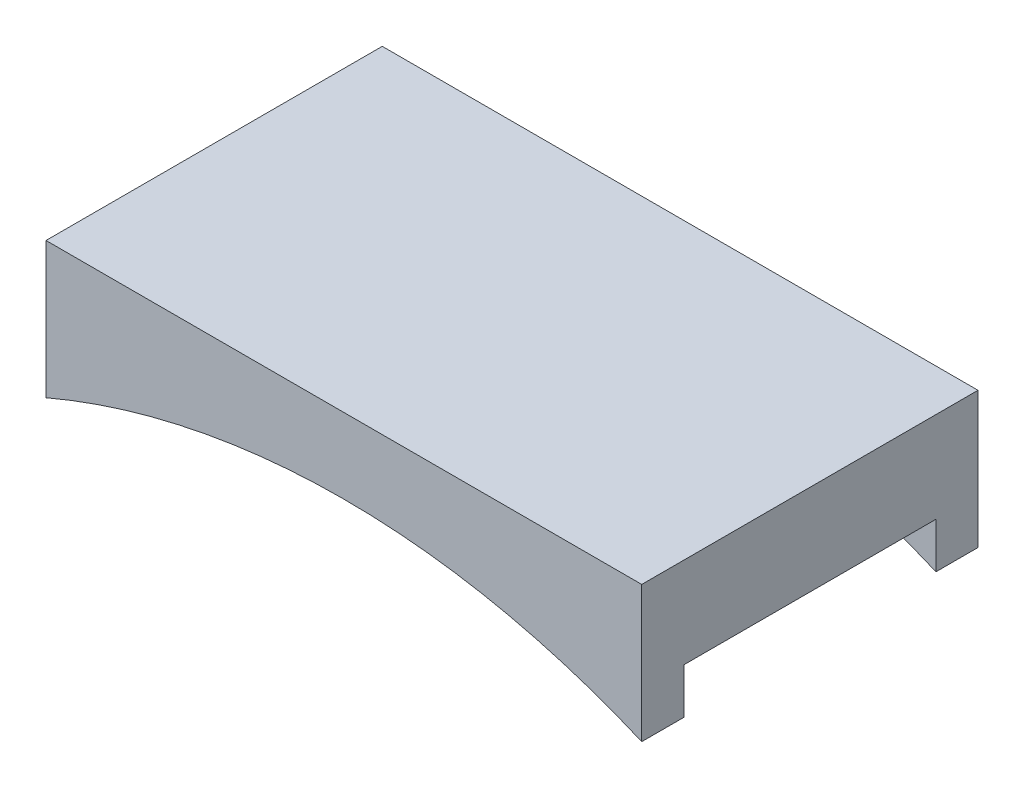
SolidWorks part; units mm, degrees
ref_plane "Front Plane" through (0, 0, 0) normal (0, 0, 1) x (1, 0, 0)
ref_plane "Top Plane" through (0, 0, 0) normal (0, 1, 0) x (1, 0, 0)
ref_plane "Right Plane" through (0, 0, 0) normal (1, 0, 0) x (0, 0, -1)
sketch "Sketch1" plane through (0, 0, 0) normal (0, 0, 1) x (1, 0, 0)
  line L1 (0, 0) -> (45, 0)
  line L2 (0, 0) -> (0, -6.85)
  line L4 (45, 0) -> (45, -6.85)
  arc A0 (45, -6.85) -> (0, -6.85) centre (22.5, -62.8219) ccw
  dimension "D2" = 120.65
  dimension "D5" = 60.325
  dimension "D1" = 45
  dimension "D3" = 6.85
  dimension "D4" = 45
  dimension "D6" = 45
extrude "Boss-Extrude1" add sketch "Sketch1" along normal mid plane 25.4
sketch "Sketch2" plane through (0, 0, 12.7) normal (0, 0, 1) x (1, 0, 0)
  line L0 (0, -10.2874) -> (0, -6.85)
  line L1 (45, -10.2874) -> (45, -6.85)
  arc A0 (0, -6.85) -> (45, -6.85) centre (22.5, -62.8219) cw
  arc A1 (0, -10.2874) -> (45, -10.2874) centre (22.5, -62.8219) cw
  arc A2 (45, -6.85) -> (0, -6.85) centre (22.5, -62.8219) ccw construction
  dimension "D1" = 57.15
extrude "Boss-Extrude2" add sketch "Sketch2" against normal blind 3.175
mirror "Mirror1" about plane through (0, 0, 0) normal (0, 0, 1) of "Boss-Extrude1", "Boss-Extrude2"
